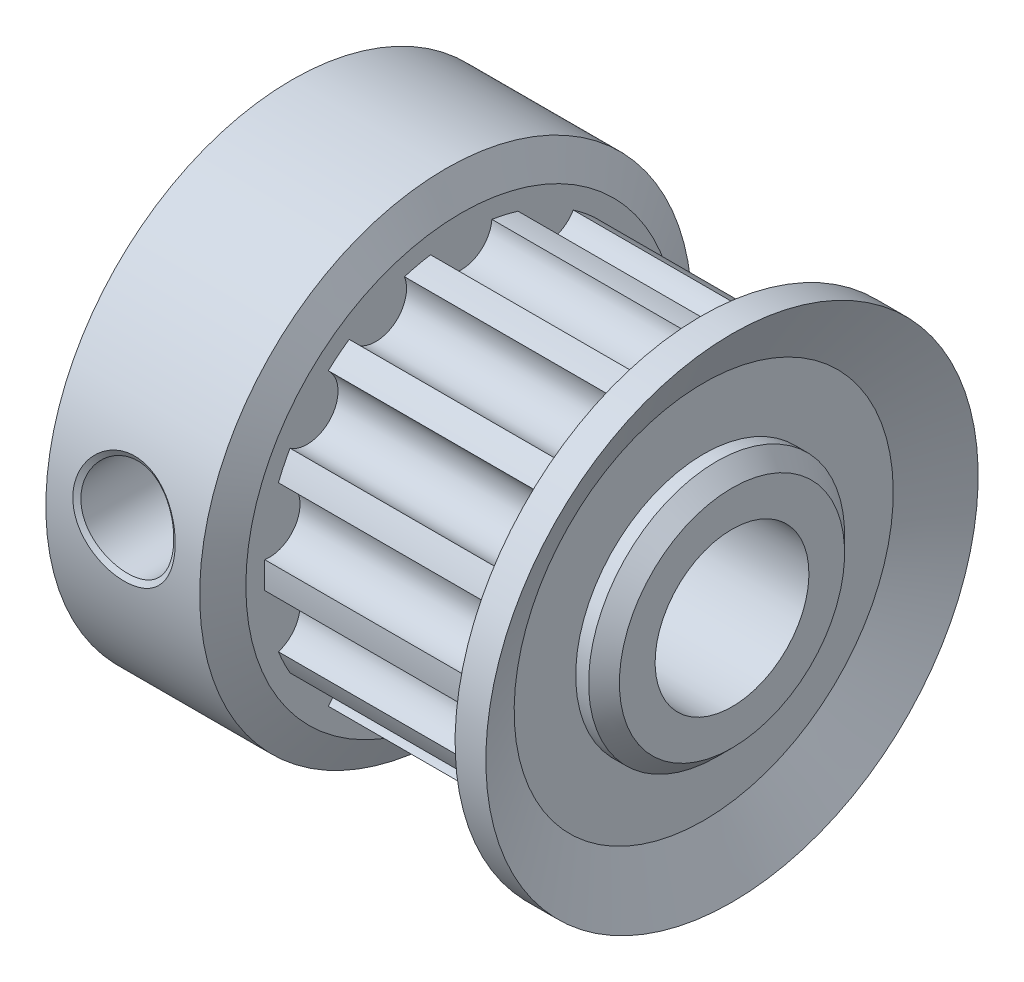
SolidWorks part; units mm, degrees
ref_plane "Front Plane" through (0, 0, 0) normal (0, 0, 1) x (1, 0, 0)
ref_plane "Top Plane" through (0, 0, 0) normal (0, 1, 0) x (1, 0, 0)
ref_plane "Right Plane" through (0, 0, 0) normal (1, 0, 0) x (0, 0, -1)
sketch "Sketch1" plane through (0, 0, 0) normal (0, 0, 1) x (1, 0, 0)
  line L0 (0, 6.2228) -> (0, -0.7772) construction
  line L1 (0, -0.7772) -> (14.8, -0.7772) construction
  line L2 (0, 6.2228) -> (0, 3.1228)
  line L3 (0.1, 3.0228) -> (0.3, 3.0228)
  line L4 (0.3, 3.0228) -> (0, 2.7228)
  line L5 (0, 2.7228) -> (0, -0.7772)
  line L6 (0, -0.7772) -> (14.8, -0.7772)
  line L7 (14.8, -0.7772) -> (14.8, 2.8828)
  line L8 (14.3, 3.3828) -> (13.88, 3.3828)
  line L9 (13.88, 3.3828) -> (13.88, 5.3828)
  line L10 (0, 6.2228) -> (0.5, 7.2228)
  line L11 (0.5, 7.2228) -> (5.5, 7.2228)
  line L12 (5.5, 7.2228) -> (6, 6.2228)
  line L13 (6, 6.2228) -> (6, 5.6228)
  line L14 (6, 5.6228) -> (13, 5.6228)
  line L15 (13, 5.6228) -> (13.8, 7.2228)
  line L16 (13.8, 7.2228) -> (14.8, 7.2228)
  line L17 (14.8, 7.2228) -> (13.88, 5.3828)
  line L18 (14.8, 2.8828) -> (14.3, 3.3828)
  arc A0 (0, 3.1228) -> (0.1, 3.0228) centre (0.1, 3.1228) ccw
  point P8 (14.8, 3.3828)
  point P21 (0, 3.0228)
  dimension "D13" = 0.1
  dimension "D1" = 14.8
  dimension "D2" = 14.8
  dimension "D3" = 8
  dimension "D4" = 1
  dimension "D5" = 5
  dimension "D6" = 6
  dimension "D7" = 0.5
  dimension "D8" = 0.5
  dimension "D9" = 1
  dimension "D10" = 3.2
  dimension "D11" = 0.3
  dimension "D12" = 0.3
  dimension "D14" = 7
  dimension "D15" = 1.84
  dimension "D16" = 2
  dimension "D17" = 6.4
revolve "Revolve2" add sketch "Sketch1" angle 360 about L6
sketch "Sketch6" plane through (14.8, 0, 0) normal (1, 0, 0) x (0, 0, -1)
  circle A0 centre (0, -0.7772) radius 2.5
  dimension "D1" = 5
extrude "Cut-Extrude1" cut sketch "Sketch6" against normal through all
sketch "Sketch10" plane through (6, 0, 0) normal (1, 0, 0) x (0, 0, -1)
  line L0 (0, -0.7772) -> (0, 5.6228) construction
  line L1 (0, -0.7772) -> (0, -7.1772) construction
  circle A0 centre (-2.7769, -6.5434) radius 1
  circle A1 centre (0, -0.7772) radius 6.4 construction
  circle A3 centre (0, -7.1772) radius 1
  circle A4 centre (-5.0037, -4.7676) radius 1
  circle A5 centre (-6.2395, -2.2014) radius 1
  circle A6 centre (-6.2395, 0.6469) radius 1
  circle A7 centre (-5.0037, 3.2131) radius 1
  circle A8 centre (-2.7769, 4.989) radius 1
  circle A9 centre (0, 5.6228) radius 1
  circle A10 centre (2.7769, 4.989) radius 1
  circle A11 centre (5.0037, 3.2131) radius 1
  circle A12 centre (6.2395, 0.6469) radius 1
  circle A13 centre (6.2395, -2.2014) radius 1
  circle A14 centre (5.0037, -4.7676) radius 1
  circle A15 centre (2.7769, -6.5434) radius 1
  point P37 (0, -0.7772)
  dimension "D1" = 14
  dimension "D2" = 2
extrude "Cut-Extrude8" cut sketch "Sketch10" along normal blind 7
sketch "Sketch11" plane through (0, 0, 0) normal (0, 0, 1) x (1, 0, 0)
  line L0 (0, 0) -> (6, 0) construction
  line L1 (6, -7.7772) -> (6, 6.2228) construction
  circle A0 centre (3, 0) radius 1.5
  dimension "D1" = 3
  dimension "D2" = 3
extrude "Cut-Extrude9" cut sketch "Sketch11" along normal blind 37
chamfer "Chamfer1" distance 0.2 angle 45 1 edges at (4.4678, 0.3091, 7.9259)
ref_plane "Plane1" through (9.5, 0, 0) normal (1, 0, 0) x (0, 0, -1)
